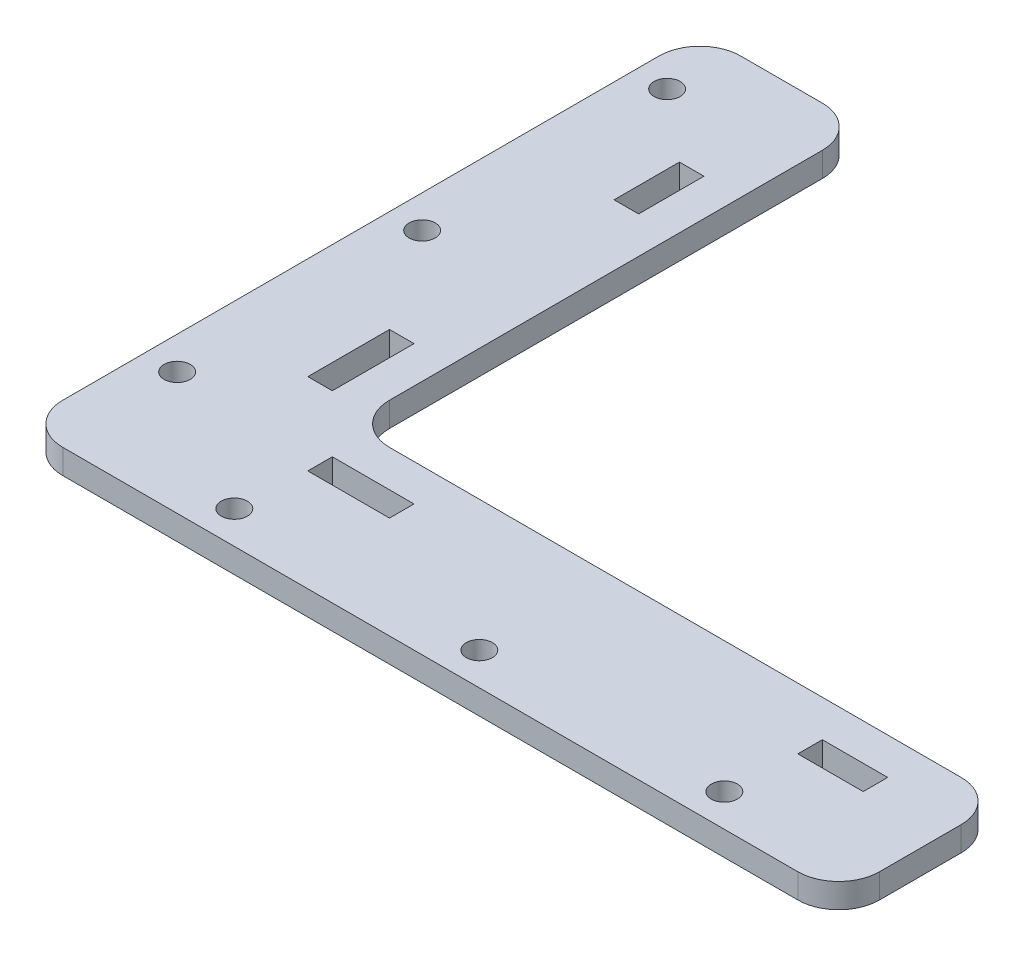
SolidWorks part; units mm, degrees
ref_plane "前视基准面" through (0, 0, 0) normal (0, 0, 1) x (1, 0, 0)
ref_plane "上视基准面" through (0, 0, 0) normal (0, 1, 0) x (1, 0, 0)
ref_plane "右视基准面" through (0, 0, 0) normal (1, 0, 0) x (0, 0, -1)
sketch "草图1" plane through (0, 0, 0) normal (0, 1, 0) x (1, 0, 0)
  line L0 (0, 0) -> (0, 63)
  line L1 (0, 63) -> (-20, 63)
  line L2 (-20, 63) -> (-20, -20)
  line L3 (-20, -20) -> (80, -20)
  line L4 (80, -20) -> (80, 0)
  line L5 (80, 0) -> (0, 0)
  dimension "D1" = 20
  dimension "D2" = 20
  dimension "D3" = 100
  dimension "D4" = 83
extrude "凸台-拉伸2" add sketch "草图1" along normal blind 3
sketch "草图2" plane through (0, 0, 0) normal (0, -1, 0) x (1, 0, 0)
  line L1 (2.5, 7.5) -> (12.5, 7.5)
  line L2 (2.5, 7.5) -> (2.5, 4.5)
  line L3 (2.5, 4.5) -> (12.5, 4.5)
  line L4 (12.5, 7.5) -> (12.5, 4.5)
  line L5 (62.5, 7.5) -> (70.5, 7.5)
  line L6 (62.5, 7.5) -> (62.5, 4.5)
  line L7 (62.5, 4.5) -> (70.5, 4.5)
  line L8 (70.5, 7.5) -> (70.5, 4.5)
  line L9 (-7.5, -2.5) -> (-4.5, -2.5)
  line L10 (-7.5, -2.5) -> (-7.5, -12.5)
  line L11 (-7.5, -12.5) -> (-4.5, -12.5)
  line L12 (-4.5, -2.5) -> (-4.5, -12.5)
  line L13 (-7.5, -40) -> (-4.5, -40)
  line L14 (-7.5, -40) -> (-7.5, -48)
  line L15 (-7.5, -48) -> (-4.5, -48)
  line L16 (-4.5, -40) -> (-4.5, -48)
extrude "切除-拉伸1" cut sketch "草图2" against normal blind 10
fillet "圆角1" radius 5 6 edges at (80, 1.5, 0) (80, 1.5, 20) (-20, 1.5, 20) (0, 1.5, 0) (-20, 1.5, -63) (0, 1.5, -63)
sketch "草图3" plane through (0, 3, 0) normal (0, 1, 0) x (1, 0, 0)
  line L0 (-15, -20) -> (75, -20) construction
  line L1 (80, -15) -> (80, -5) construction
  circle A0 centre (62, -16) radius 1.6
  dimension "D1" = 3.2
  dimension "D2" = 4
  dimension "D3" = 18
extrude "切除-拉伸2" cut sketch "草图3" against normal through all
pattern_linear "阵列(线性)1" count 3 spacing 30 along (-1, 0, 0) of "切除-拉伸2"
sketch "草图4" plane through (0, 3, 0) normal (0, 1, 0) x (1, 0, 0)
  line L0 (-20, 58) -> (-20, -15) construction
  line L1 (-5, 63) -> (-15, 63) construction
  circle A0 centre (-16, 55) radius 1.6
  dimension "D1" = 3.2
  dimension "D3" = 8
  dimension "D2" = 4
extrude "切除-拉伸3" cut sketch "草图4" against normal through all
pattern_linear "阵列(线性)2" count 3 spacing 30 along (0, 0, 1) of "切除-拉伸3"
